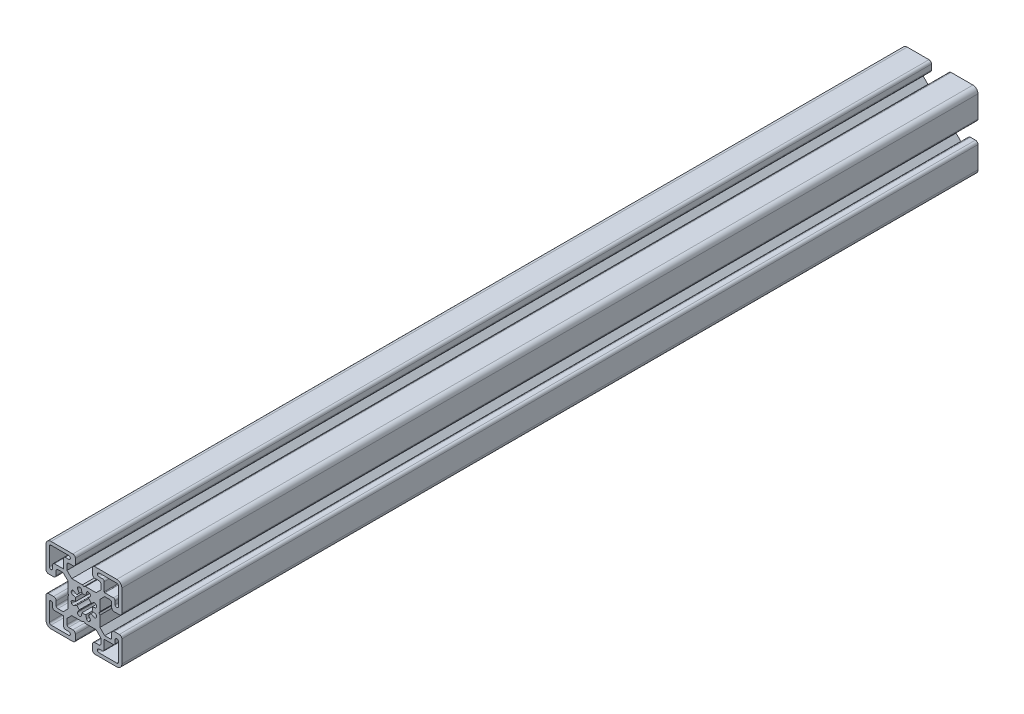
SolidWorks part; units mm, degrees
ref_plane "Front Plane" through (0, 0, 0) normal (0, 0, 1) x (1, 0, 0)
ref_plane "Top Plane" through (0, 0, 0) normal (0, 1, 0) x (1, 0, 0)
ref_plane "Right Plane" through (0, 0, 0) normal (1, 0, 0) x (0, 0, -1)
ref_plane "RIGHT" through (0, 0, 0) normal (1, 0, 0) x (0, 1, 0)
ref_plane "TOP" through (0, 0, 0) normal (0, 1, 0) x (0, 0, 1)
ref_plane "FRONT" through (0, 0, 0) normal (0, 0, 1) x (1, 0, 0)
imported_body "Imported1"
sketch "Sketch2" plane through (0, 0, -3048) normal (0, 0, -1) x (-1, 0, 0)
  line L1 (24.42, -24.4734) -> (-24.796, -24.4734)
  line L2 (24.42, -24.4734) -> (24.42, 24.7426)
  line L3 (24.42, 24.7426) -> (-24.796, 24.7426)
  line L4 (-24.796, -24.4734) -> (-24.796, 24.7426)
extrude "Cut-Extrude1" cut sketch "Sketch2" against normal up to surface (2540 mm away)
